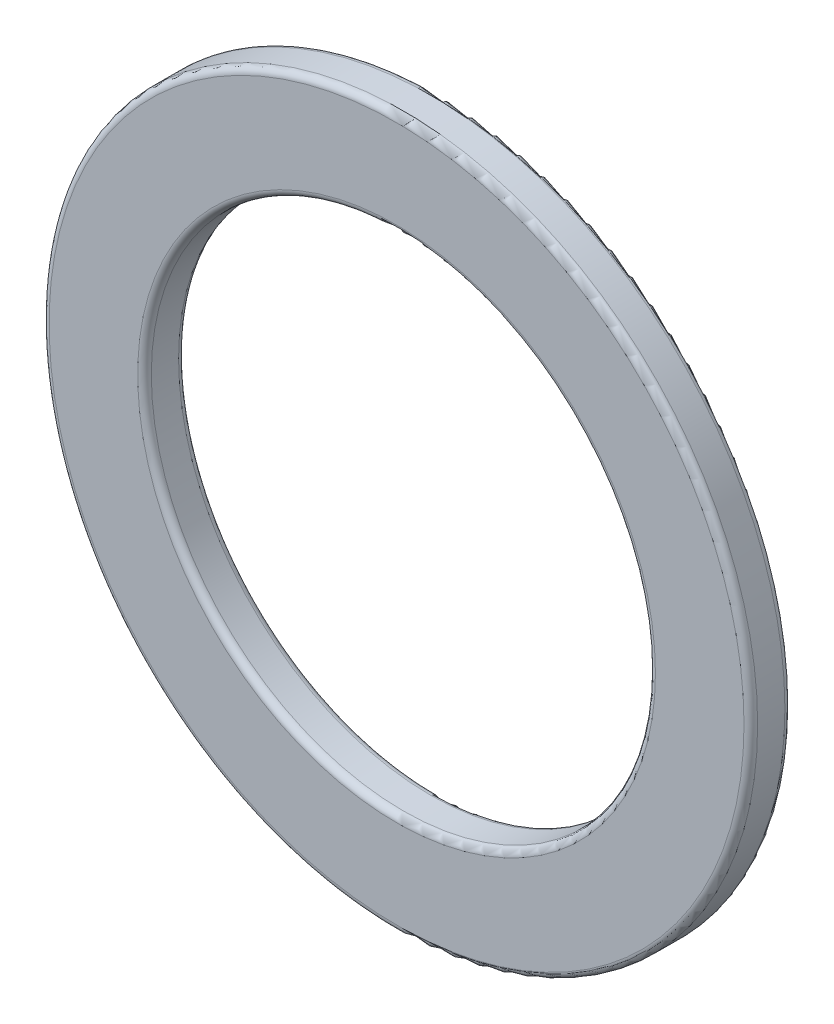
SolidWorks part; units mm, degrees
ref_plane "Face" through (0, 0, 0) normal (0, 0, 1) x (1, 0, 0)
ref_plane "Dessus" through (0, 0, 0) normal (0, 1, 0) x (1, 0, 0)
ref_plane "Profil" through (0, 0, 0) normal (1, 0, 0) x (0, 0, -1)
sketch "Esquisse1" plane through (0, 0, 0) normal (0, 0, 1) x (1, 0, 0)
  circle A0 centre (0, 0) radius 26
  circle A1 centre (0, 0) radius 18.5
  dimension "D1" = 52
  dimension "D2" = 37
extrude "Base-Extrusion" add sketch "Esquisse1" along normal blind 3
fillet "Congé1" radius 0.5
sketch "Esquisse2" plane through (0, 0, 0) normal (0, 0, 1) x (1, 0, 0)
  line L0 (0, 0) -> (0, -32.0462)
  line L1 (0, 0) -> (22.6601, 22.6601)
  arc A0 (22.6601, 22.6601) -> (0, -32.0462) centre (0, 0) cw
  dimension "D1" = 135
extrude "Coupe" cut sketch "Esquisse2" along normal through all
